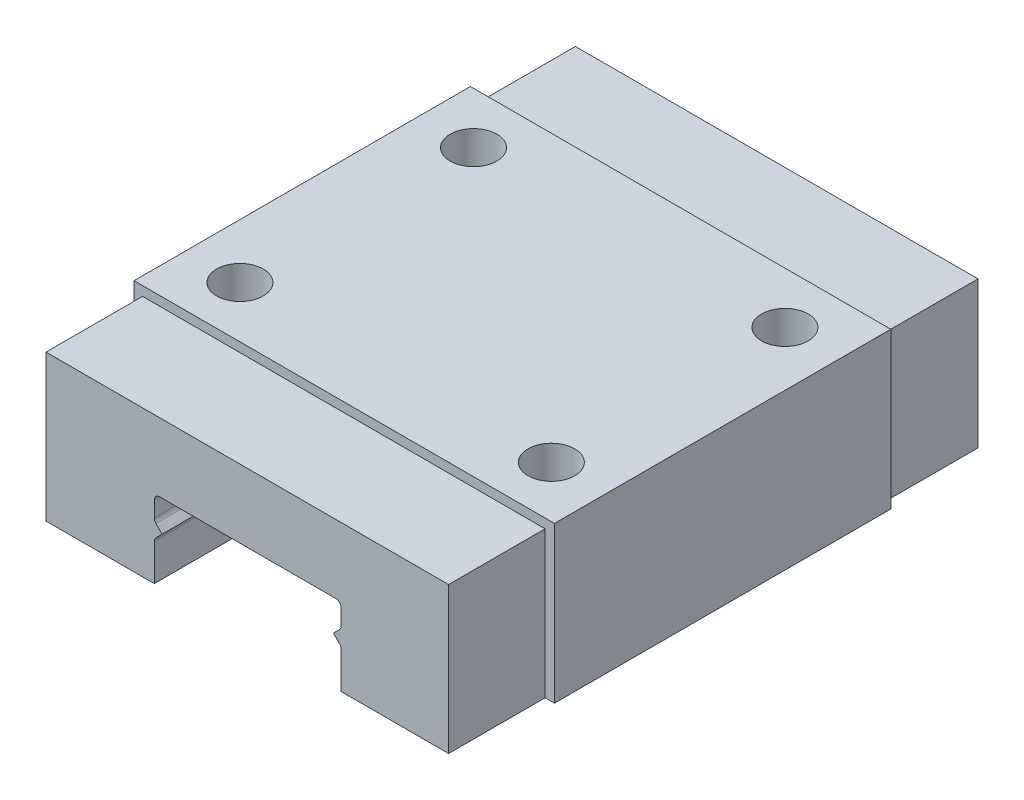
SolidWorks part; units mm, degrees
ref_plane "Front" through (0, 0, 0) normal (0, 0, 1) x (1, 0, 0)
ref_plane "Top" through (0, 0, 0) normal (0, 1, 0) x (1, 0, 0)
ref_plane "Right" through (0, 0, 0) normal (1, 0, 0) x (0, 0, -1)
sketch "Sketch1" plane through (0, 0, 0) normal (0, 0, 1) x (1, 0, 0)
  line L1 (-13.5, 13) -> (13.5, 13)
  line L2 (-13.5, 13) -> (-13.5, 3)
  line L3 (-13.5, 3) -> (13.5, 3)
  line L4 (13.5, 13) -> (13.5, 3)
  point P4 (0, 3)
  dimension "D1" = 27
  dimension "D2" = 10
  dimension "D3" = 13
extrude "Extrude1" add sketch "Sketch1" along normal blind 34
ref_plane "Plane1" through (0, 0, 17) normal (0, 0, 1) x (1, 0, 0)
sketch "Sketch2" plane through (0, 0, 0) normal (0, 0, -1) x (-1, 0, 0)
  line L0 (5.5, 6) -> (6, 5.5)
  line L1 (0, 8) -> (6, 8)
  line L2 (0, 8) -> (0, 0.8302)
  line L3 (0, 0.8302) -> (6, 0.8302)
  line L4 (6, 0.8302) -> (6, 5.5)
  line L5 (6, 8) -> (6, 6.5)
  line L6 (6, 6.5) -> (5.5, 6)
  dimension "D1" = 8
  dimension "D2" = 6
  dimension "D3" = 1
  dimension "D4" = 1.5
extrude "Cut-Extrude1" cut sketch "Sketch2" against normal through all
fillet "Fillet1" radius 0.35 3 edges at (-6, 6.5, 17) (-6, 8, 17) (-6, 5.5, 17)
mirror "Mirror1" about plane through (0, 0, 0) normal (1, 0, 0) of "Cut-Extrude1", "Fillet1"
hole_wizard "M3x0.5 Tapped Hole1" positions "Sketch4" profile "Sketch3" tap size "M3x0.5" standard "Ansi Metric"
sketch "Sketch4" plane through (0, 13, 0) normal (0, 1, 0) x (-1, 0, 0)
  line L1 (5.5, 17) -> (-5.5, 17) construction
  line L2 (-13.5, 0) -> (13.5, 0) construction
  point P0 (10, 9.5)
  dimension "D1" = 7.5
  dimension "D2" = 10
  dimension "D3" = 9.5
sketch "Sketch3" plane through (-10, 13, 9.5) normal (1, 0, 0) x (0, 0, 1)
  line L0 (0, 0) -> (0, 5.7511)
  line L1 (0, 5.7511) -> (1.25, 5)
  line L2 (1.25, 5) -> (1.25, 3.5)
  line L3 (1.25, 3.5) -> (1.5, 3.5)
  line L4 (1.5, 3.5) -> (1.5, 0)
  line L5 (1.5, 0) -> (0, 0)
  line L10 (0, 5.7511) -> (-1.25, 5) construction
  line L11 (0, -6.35) -> (0, 107.95) construction
  dimension "Tap Drill Dia." = 2.5
  dimension "Tap Drill Depth" = 5
  dimension "Thread Major Dia." = 3
  dimension "Thread Depth" = 3.5
  dimension "Drill Angle" = 118
pattern_linear "LPattern1" count 2 spacing 20 along (1, 0, 0) count 2 spacing 15 along (0, 0, 1) of "M3x0.5 Tapped Hole1"
sketch "Sketch5" plane through (0, 0, 0) normal (0, 0, -1) x (-1, 0, 0)
  line L0 (-6, 3) -> (-13.5, 3) construction
  line L1 (-12.9, 12.4) -> (12.9557, 12.4)
  line L2 (-12.9, 12.4) -> (-12.9, 3)
  line L3 (-12.9, 3) -> (12.9557, 3)
  line L4 (12.9557, 12.4) -> (12.9557, 3)
  line L5 (-13.5, 13) -> (13.5, 13) construction
  line L6 (-13.5, 3) -> (-13.5, 13) construction
  dimension "D1" = 0.6
  dimension "D2" = 0.6
extrude "Cut-Extrude2" cut sketch "Sketch5" against normal blind 6.2 flip side to cut
mirror "Mirror2" about plane through (0, 0, 17) normal (0, 0, 1) of "Cut-Extrude2"
